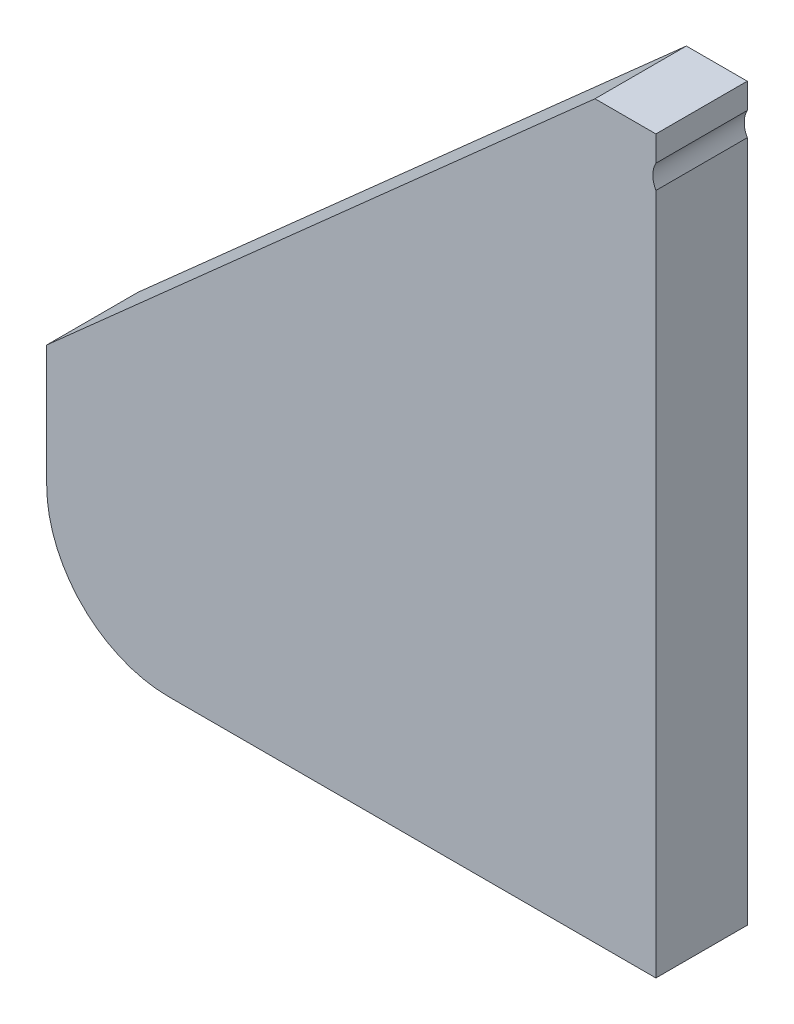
SolidWorks part; units mm, degrees
ref_plane "Face" through (0, 0, 0) normal (0, 0, 1) x (1, 0, 0)
ref_plane "Dessus" through (0, 0, 0) normal (0, 1, 0) x (1, 0, 0)
ref_plane "Droite" through (0, 0, 0) normal (1, 0, 0) x (0, 0, -1)
sketch "Esquisse1" plane through (0, 0, 0) normal (0, 0, 1) x (1, 0, 0)
  line L0 (-10, 120) -> (-100, 40)
  line L1 (-10, 120) -> (0, 120)
  line L2 (-100, 40) -> (-100, 20)
  line L3 (-80, 0) -> (0, 0)
  line L4 (0, 120) -> (0, 0)
  arc A0 (-80, 0) -> (-100, 20) centre (-80, 20) cw
  point P6 (-100, 0)
  dimension "D5" = 20
  dimension "D1" = 10
  dimension "D2" = 40
  dimension "D3" = 100
  dimension "D4" = 120
extrude "Base-Extrusion" add sketch "Esquisse1" along normal blind 15
sketch "Esquisse2" plane through (0, 0, 0) normal (0, 0, -1) x (-1, 0, 0)
  line L0 (0, 120) -> (10, 120) construction
  line L1 (0, 0) -> (0, 120) construction
  circle A0 centre (-3.5, 113.9) radius 4
  dimension "D1" = 8
  dimension "D2" = 6.1
  dimension "D3" = 3.5
extrude "Enlèv. mat.-Extru.1" cut sketch "Esquisse2" against normal through all
